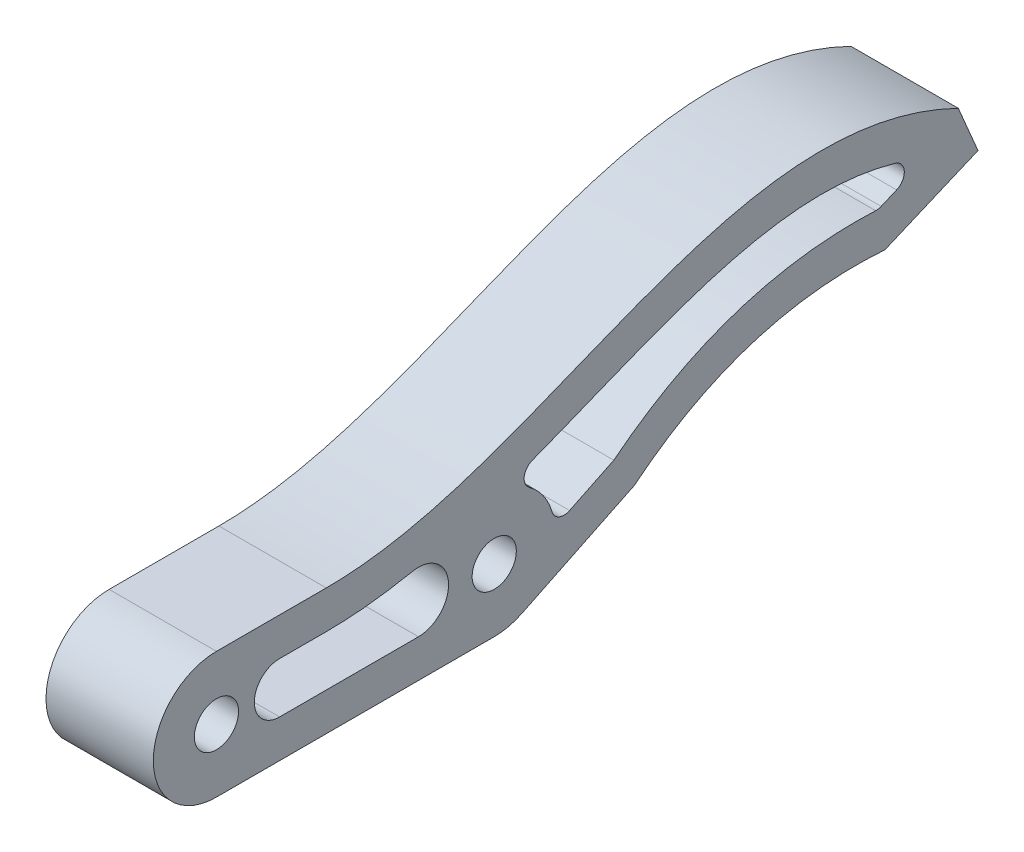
SolidWorks part; units mm, degrees
ref_plane "Front Plane" through (0, 0, 0) normal (0, 0, 1) x (1, 0, 0)
ref_plane "Top Plane" through (0, 0, 0) normal (0, 1, 0) x (1, 0, 0)
ref_plane "Right Plane" through (0, 0, 0) normal (1, 0, 0) x (0, 0, -1)
sketch "Sketch1" plane through (0, 0, 0) normal (1, 0, 0) x (0, 0, -1)
  line L1 (0, 0) -> (27, 0)
  line L2 (0, 0) -> (0, 10)
  line L3 (0, 10) -> (27, 10)
  circle A0 centre (5, 5) radius 1.75
  circle A1 centre (5, 5) radius 5
  circle A2 centre (27, 5) radius 5
  circle A3 centre (27, 5) radius 1.75
  dimension "D7" = 3.5
  dimension "D11" = 10
  dimension "D2" = 3.5
  dimension "D1" = 10
  dimension "D8" = 5
  dimension "D9" = 5
  dimension "D10" = 22
extrude "Boss-Extrude1" add sketch "Sketch1" along normal blind 8.5 contours A1 A0 | A2 L3 A1 L1 | A2 A3 | L2 A1 | L1 A1
sketch "Sketch2" plane through (8.5, 0, 0) normal (1, 0, 0) x (0, 0, -1)
  line L6 (5, 10) -> (27, 10) construction
  line L14 (5, 10) -> (27, 10)
  line L20 (29.1838, 0.5021) -> (38.0854, 4.8241)
  line L21 (57.948, 11.0678) -> (65.3138, 14.1895)
  line L22 (65.3138, 14.1895) -> (63.753, 17.8724)
  arc A3 (27, 0) -> (27, 10) centre (27, 5) ccw construction
  arc A4 (27, 0) -> (27, 10) centre (27, 5) ccw
  spline S0 degree 2 poles (38.0854, 4.8241) (46.7975, 11.8952) (57.948, 11.0678) knots 0 0 0 1 1 1
  spline S1 degree 3 poles (63.753, 17.8724) (45.9289, 26.5638) (31.0593, 10) (13.695, 10) knots 0 0 0 0 1 1 1 1
  point P2 (27, 5)
  dimension "D3" = 4
  dimension "D4" = 8
extrude "Boss-Extrude2" add sketch "Sketch2" against normal blind 8.5
sketch "Sketch4" plane through (0, 0, 0) normal (-1, 0, 0) x (0, 0, 1)
  line L2 (-13.695, 7) -> (-5, 7)
  line L3 (-13.695, 7) -> (-10, 7)
  line L7 (-5, 3.25) -> (-5, 6.75) construction
  line L8 (-10, 3) -> (-10, 7) construction
  line L9 (-5, 3) -> (-27, 3)
  line L10 (-27.8735, 3.2009) -> (-36.4706, 7.3749)
  line L11 (-10, 3) -> (-21, 3)
  line L12 (-31.7493, 5.0826) -> (-36.4706, 7.3749)
  line L13 (-27.4482, 3.0509) -> (-26.0367, 9.1895) construction
  line L16 (-56.7774, 13.83) -> (-64.1432, 16.9517)
  line L17 (-57.4302, 14.1067) -> (-61.2388, 15.7208)
  circle A2 centre (-5, 5) radius 1.75 construction
  arc A3 (-27.8735, 3.2009) -> (-27, 3) centre (-27, 5) ccw
  arc A5 (-10, 3) -> (-10, 7) centre (-10, 5) ccw
  arc A7 (-20.5267, 7.7198) -> (-21, 3) centre (-21, 5.3836) ccw
  arc A9 (-27.5926, 9.7129) -> (-31.7493, 5.0826) centre (-27, 5) ccw
  spline S2 degree 3 poles (-3408.4577, 1440.7845) (-247.7865, -1514.3456) (109.9802, -70.5125) (-43.0807, 11.5318) (-44.8465, 12.2714) (-48.4888, 13.3934) (-50.3649, 13.7757) (-223.3908, 32.1234) (-742.8872, -1367.1402) (3536.8007, -685.3874) knots -21.987752 -21.987752 -21.987752 -21.987752 0.25 0.25 0.5 0.5 0.75 0.75 23.027196 23.027196 23.027196 23.027196 only from (-36.4706, 7.3749) to (-58.17, 14.0596)
  spline S3 degree 3 poles (-3074.5595, -6302.8146) (-239.8232, -386.0768) (-126.8421, 4.6892) (-54.8019, 17.4059) (-52.9551, 17.4662) (-49.2263, 17.1706) (-47.345, 16.8125) (-43.5217, 15.7923) (-41.5813, 15.1303) (-37.6352, 13.6452) (-35.63, 12.8224) (-31.539, 11.1764) (-29.4531, 10.3531) (-25.1719, 8.8785) (-22.9758, 8.227) (67.5464, -10.5358) (264.9232, 247.746) (480.5342, 6978.7847) knots -4.556725 -4.556725 -4.556725 -4.556725 0.125 0.125 0.25 0.25 0.375 0.375 0.5 0.5 0.625 0.625 0.75 0.75 0.875 0.875 5.742173 5.742173 5.742173 5.742173 only from (-62.4381, 15.1759) to (-13.695, 7)
  spline S4 degree 3 poles (-61.2388, 15.7208) (-59.681, 16.3767) (-58.1685, 16.8116) (-54.8019, 17.4059) (-52.9551, 17.4662) (-49.2263, 17.1706) (-47.345, 16.8125) (-43.5217, 15.7923) (-41.5813, 15.1303) (-37.6352, 13.6452) (-35.63, 12.8224) (-31.6284, 11.2123) (-29.6353, 10.425) (-27.5926, 9.7129) knots 0.025371 0.025371 0.025371 0.025371 0.125 0.125 0.25 0.25 0.375 0.375 0.5 0.5 0.625 0.625 0.744541 0.744541 0.744541 0.744541
  spline S5 degree 3 poles (-36.4706, 7.3749) (-38.0402, 8.6233) (-39.6775, 9.7076) (-43.0807, 11.5318) (-44.8465, 12.2714) (-48.4888, 13.3934) (-50.3649, 13.7757) (-53.968, 14.1578) (-55.6847, 14.1991) (-57.4302, 14.1067) knots 0 0 0 0 0.25 0.25 0.5 0.5 0.75 0.75 0.969114 0.969114 0.969114 0.969114
  spline S6 degree 1 poles (-60.2687, 13.4167) (-28.4156, 7.3522) knots 0 0 1 1 construction
  spline S7 degree 3 poles (-60.2687, 13.4167) (-59.9615, 13.546) (-59.3325, 13.7926) (-58.1178, 14.1982) (-56.622, 14.5725) (-54.8521, 14.8323) (-52.4942, 14.9501) (-49.4823, 14.7019) (-45.6809, 13.8466) (-41.6757, 12.5278) (-37.4783, 10.8859) (-33.8114, 9.3855) (-30.7729, 8.2009) (-29.2008, 7.6259) (-28.4156, 7.3522) knots 0.025371 0.025371 0.025371 0.025371 0.047845 0.070319 0.115267 0.160215 0.205164 0.29506 0.384956 0.474852 0.564749 0.654645 0.699593 0.744541 0.744541 0.744541 0.744541 construction
  spline S9 degree 3 poles (-20.5267, 7.7198) (-18.3171, 7.2722) (-16.0394, 7) (-13.695, 7) knots 0.878351 0.878351 0.878351 0.878351 1 1 1 1
  dimension "D3" = 5
  dimension "D5" = 6
  dimension "D1" = 3
  dimension "D2" = 3
  dimension "D4" = 2.5
  dimension "D6" = 3
extrude "Cut-Extrude1" cut sketch "Sketch4" against normal through all
fillet "Fillet1" radius 1 4 edges at (4.25, 5.0826, -31.7493)
